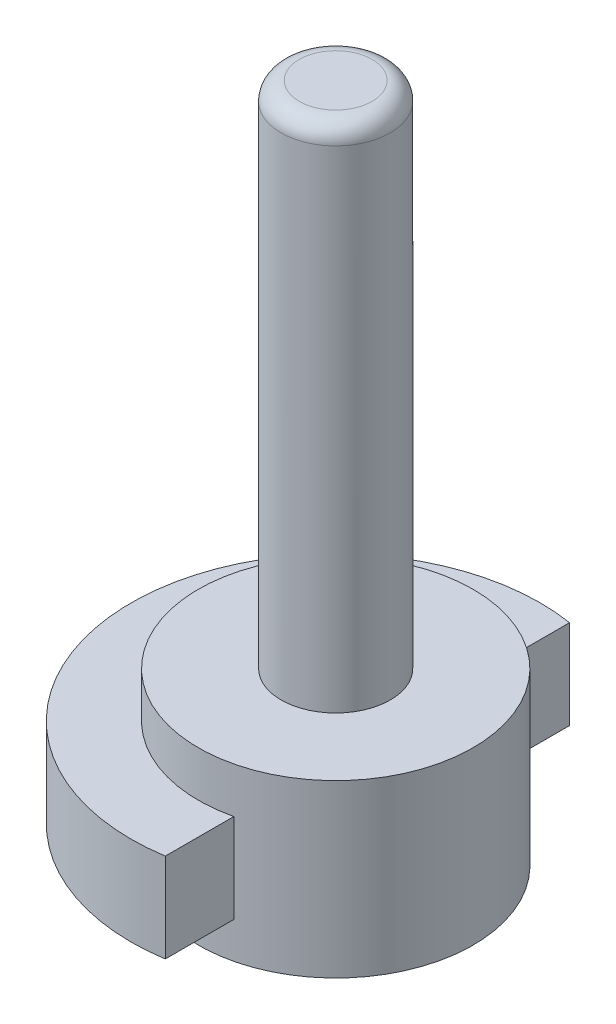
SolidWorks part; units mm, degrees
ref_plane "Front Plane" through (0, 0, 0) normal (0, 0, 1) x (1, 0, 0)
ref_plane "Top Plane" through (0, 0, 0) normal (0, 1, 0) x (1, 0, 0)
ref_plane "Right Plane" through (0, 0, 0) normal (1, 0, 0) x (0, 0, -1)
sketch "Sketch1" plane through (0, 0, 0) normal (0, 1, 0) x (1, 0, 0)
  line L0 (0, 0) -> (-18.1905, 0) construction
  circle A0 centre (0, 0) radius 3
  dimension "D1" = 6
extrude "Boss-Extrude1" add sketch "Sketch1" along normal blind 28
sketch "Sketch2" plane through (0, 0, 0) normal (0, -1, 0) x (-1, 0, 0)
  circle A0 centre (0, 0) radius 7.55
  dimension "D1" = 15.1
extrude "Boss-Extrude2" add sketch "Sketch2" along normal blind 2.5
fillet "Fillet2" radius 1 1 edges at (0, 28, 3)
sketch "Sketch3" plane through (0, -2.5, 0) normal (0, -1, 0) x (-1, 0, 0)
  circle A0 centre (0, 0) radius 11.25
  dimension "D1" = 22.5
extrude "Boss-Extrude3" add sketch "Sketch3" along normal blind 4.9
sketch "Sketch5" plane through (0, -7.4, 0) normal (0, -1, 0) x (1, 0, 0)
  circle A0 centre (0, 0) radius 7.55
  dimension "D1" = 15.1
extrude "Boss-Extrude5" add sketch "Sketch5" along normal blind 2
sketch "Sketch6" plane through (0, -2.5, 0) normal (0, 1, 0) x (1, 0, 0)
  line L0 (1.7463, -7.3453) -> (17.2708, -7.3453)
  line L3 (1.7463, 7.3453) -> (17.2708, 7.3453)
  line L4 (17.2708, -7.3453) -> (17.2708, 7.3453)
  line L5 (1.7463, -7.3453) -> (1.7463, 7.3453) construction
  line L7 (7.55, 0) -> (17.2708, -7.3453) construction
  line L8 (7.55, 0) -> (17.2708, 7.3453) construction
  circle A0 centre (0, 0) radius 7.55 construction
  arc A1 (1.7463, -7.3453) -> (1.7463, 7.3453) centre (0, 0) ccw
  point P3 (7.55, 0)
  dimension "D2" = 14.6906
extrude "Cut-Extrude1" cut sketch "Sketch6" against normal blind 10
sketch "Sketch8" plane through (0, -2.5, 0) normal (0, 1, 0) x (1, 0, 0)
  line L0 (8.5211, 7.3453) -> (1.7463, 7.3453) construction
  line L1 (1.7463, -7.3453) -> (8.5211, -7.3453) construction
  line L2 (8.5211, 7.3453) -> (1.7463, 7.3453)
  line L3 (1.7463, -7.3453) -> (8.5211, -7.3453)
  line L4 (1.7463, -7.3453) -> (1.7463, -11.1136)
  line L5 (1.7463, 7.3453) -> (1.7463, 11.1136)
  arc A0 (8.5211, 7.3453) -> (8.5211, -7.3453) centre (0, 0) ccw construction
  arc A2 (8.5211, 7.3453) -> (1.7463, 11.1136) centre (0, 0) ccw
  arc A4 (1.7463, -11.1136) -> (8.5211, -7.3453) centre (0, 0) ccw
  point P6 (1.7463, -7.3453)
  point P7 (1.7463, 7.3453)
extrude "Cut-Extrude2" cut sketch "Sketch8" against normal blind 10
